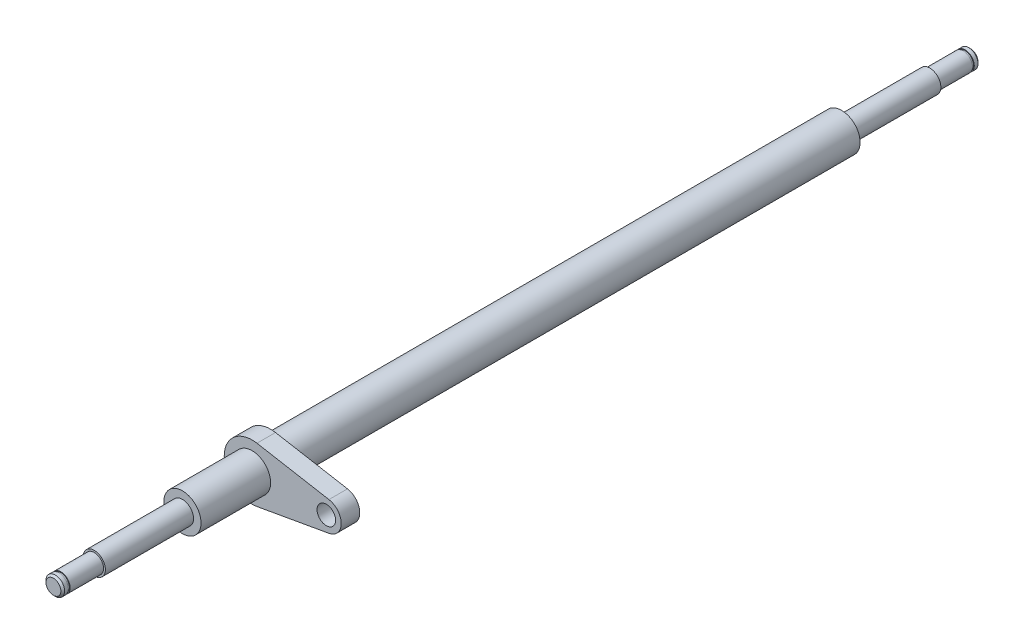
SolidWorks part; units mm, degrees
ref_plane "Ebene vorne" through (0, 0, 0) normal (0, 0, 1) x (1, 0, 0)
ref_plane "Ebene oben" through (0, 0, 0) normal (0, 1, 0) x (1, 0, 0)
ref_plane "Ebene rechts" through (0, 0, 0) normal (1, 0, 0) x (0, 0, -1)
sketch "Skizze1" plane through (0, 0, 0) normal (1, 0, 0) x (0, 0, -1)
  line L0 (0, 0) -> (-287.1356, 0) construction
  line L1 (0, 0) -> (0, 6)
  line L2 (0, 6) -> (-225, 6)
  line L3 (-225, 6) -> (-225, 5)
  line L4 (-225, 5) -> (-243, 5)
  line L5 (-243, 5) -> (-243, 4.6)
  line L6 (-243, 4.6) -> (-244, 4.6)
  line L7 (-244, 4.6) -> (-244, 5)
  line L8 (-244, 5) -> (-246, 5)
  line L9 (-246, 5) -> (-247, 4)
  line L10 (-247, 4) -> (-247, 0)
  line L11 (-247, 0) -> (0, 0)
  dimension "D1" = 225
  dimension "D2" = 1
  dimension "D3" = 9.2
  dimension "D4" = 1
  dimension "D5" = 10
  dimension "D6" = 247
  dimension "D7" = 243
  dimension "D8" = 18
  dimension "D9" = 12
revolve "Rotation1" add sketch "Skizze1" angle 360 about L0
ref_plane "Ebene1" through (-5, 0, 0) normal (1, 0, 0) x (0, 0, -1)
sketch "Skizze2" plane through (-5, 0, 0) normal (1, 0, 0) x (0, 0, -1)
  line L0 (-240, 0) -> (-228, 0) construction
  line L1 (-240, 2) -> (-228, 2)
  line L2 (-240, -2) -> (-228, -2)
  line L3 (-228, 0) -> (0, 0) construction
  line L4 (-225, 6) -> (-225, -6) construction
  line L5 (-243, 5) -> (-243, -5) construction
  arc A0 (-240, 2) -> (-240, -2) centre (-240, 0) ccw
  arc A1 (-228, -2) -> (-228, 2) centre (-228, 0) ccw
  point P3 (-234, 0)
  dimension "D2" = 3
  dimension "D3" = 3
  dimension "D1" = 4
extrude "Schnitt-Linear austragen1" cut sketch "Skizze2" along normal blind 2.4
mirror "Spiegeln1" about plane through (0, 0, 0) normal (0, 0, -1)
sketch "Skizze3" plane through (0, 0, 0) normal (0, 0, 1) x (1, 0, 0)
  circle A0 centre (0, 0) radius 10
  dimension "D1" = 20
extrude "Aufsatz-Linear austragen1" add sketch "Skizze3" along normal mid plane 355
sketch "Skizze4" plane through (0, 0, 177.5) normal (0, 0, 1) x (1, 0, 0)
  line L0 (0, 0) -> (78.5782, 0) construction
  line L1 (0, 0) -> (0, -32.2999) construction
  line L2 (2.625, -14.7685) -> (41.4, -7.8765)
  line L3 (41.4, 7.8765) -> (2.625, 14.7685)
  circle A0 centre (40, 0) radius 5
  arc A1 (41.4, -7.8765) -> (41.4, 7.8765) centre (40, 0) ccw
  arc A2 (2.625, 14.7685) -> (2.625, -14.7685) centre (0, 0) ccw
  circle A3 centre (0, 0) radius 10 construction
  circle A4 centre (0, 0) radius 10
  dimension "D2" = 10
  dimension "D4" = 15
  dimension "D5" = 8
  dimension "D1" = 90
  dimension "D3" = 40
extrude "Aufsatz-Linear austragen2" add sketch "Skizze4" along normal mid plane 10 from offset 42.5 separate body
